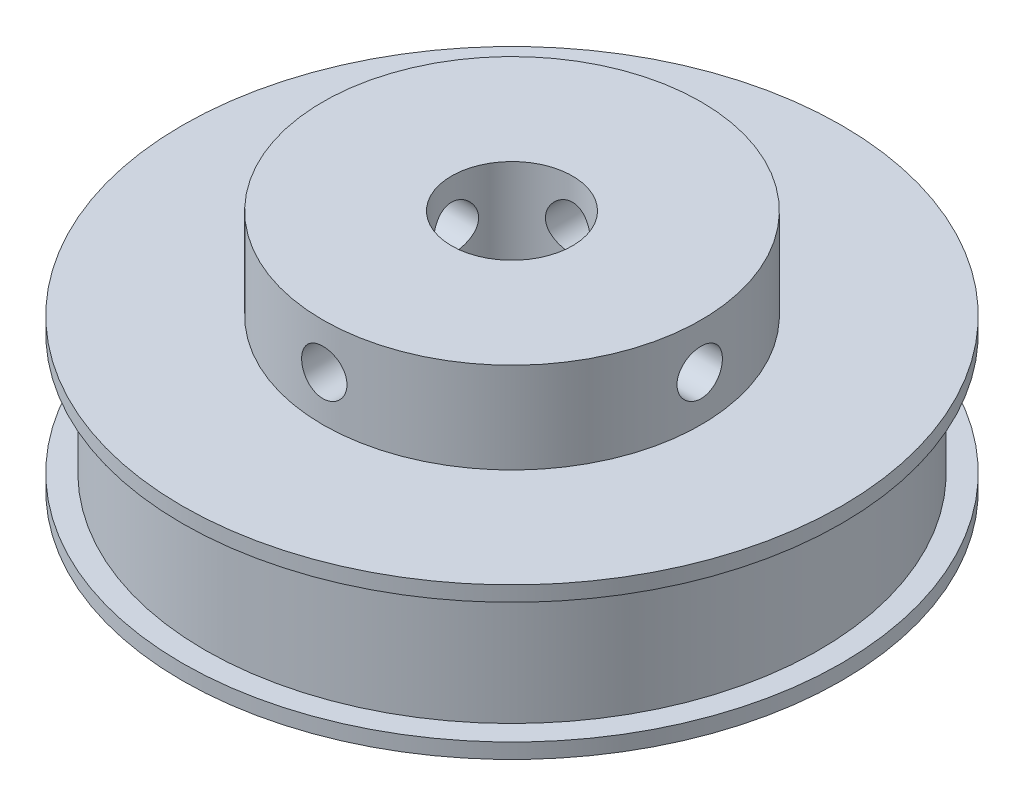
SolidWorks part; units mm, degrees
ref_plane "前视基准面" through (0, 0, 0) normal (0, 0, 1) x (1, 0, 0)
ref_plane "上视基准面" through (0, 0, 0) normal (0, 1, 0) x (1, 0, 0)
ref_plane "右视基准面" through (0, 0, 0) normal (1, 0, 0) x (0, 0, -1)
other "Configuration Table"
sketch "草图2" plane through (0, 0, 0) normal (0, 1, 0) x (1, 0, 0)
  circle A0 centre (0, 0) radius 21.8
  dimension "D1" = 43.6
extrude "凸台-拉伸1" add sketch "草图2" along normal blind 16
sketch "草图3" plane through (0, 16, 0) normal (0, 1, 0) x (1, 0, 0)
  circle A0 centre (0, 0) radius 4
  dimension "D1" = 8
extrude "切除-拉伸1" cut sketch "草图3" against normal through all
sketch "草图4" plane through (0, 16, 0) normal (0, 1, 0) x (1, 0, 0)
  circle A0 centre (0, 0) radius 12.5
  dimension "D1" = 25
extrude "切除-拉伸2" cut sketch "草图4" against normal blind 6 flip side to cut
ref_plane "基准面1" through (0, 1, 0) normal (0, 1, 0) x (1, 0, 0)
sketch "草图5" plane through (0, 1, 0) normal (0, 1, 0) x (1, 0, 0)
  circle A0 centre (0, 0) radius 20.3
  dimension "D1" = 40.6
extrude "切除-拉伸3" cut sketch "草图5" along normal blind 8 flip side to cut
sketch "草图6" plane through (0, 0, 0) normal (1, 0, 0) x (0, 0, -1)
  line L0 (0, 8.8) -> (0, -8.8) construction
  line L1 (12.5, 16) -> (-12.5, 16) construction
  circle A0 centre (0, 13) radius 1.5
  dimension "D1" = 3
  dimension "D2" = 3
extrude "切除-拉伸4" cut sketch "草图6" against normal through all and the other way through all
sketch "草图7" plane through (0, 0, 0) normal (0, 0, 1) x (1, 0, 0)
  line L0 (0, -8.8) -> (0, 8.8) construction
  line L1 (12.5, 16) -> (-12.5, 16) construction
  circle A0 centre (0, 13) radius 1.5
  dimension "D1" = 3
  dimension "D2" = 3
extrude "切除-拉伸5" cut sketch "草图7" against normal through all and the other way through all
